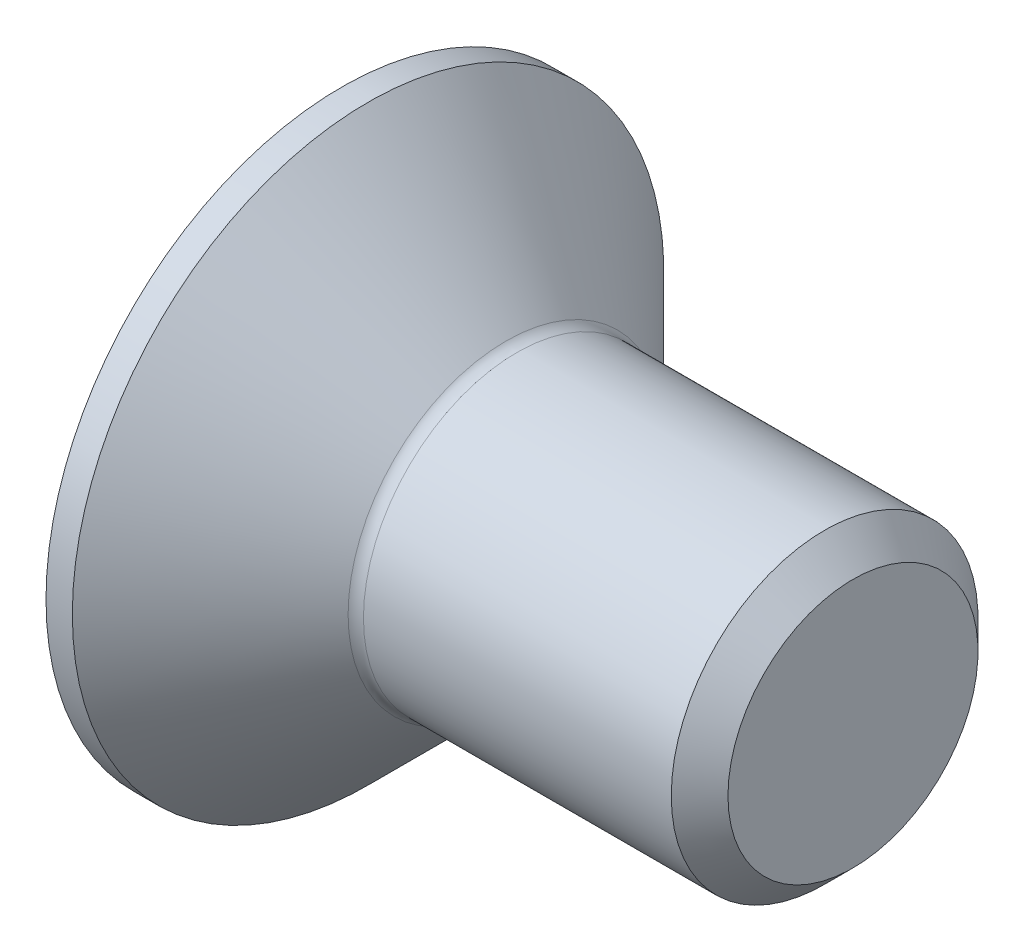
SolidWorks part; units mm, degrees
revolve "PreBroach" cut sketch "Sketch2"
sketch "Sketch2"
  line L0 (0, 2.01) -> (2.5, 2.01)
  line L1 (2.5, 2.01) -> (3.6605, 0)
  line L2 (0, 0) -> (127, 0) construction
  line L3 (3.6605, 0) -> (0, 0)
  line L4 (0, 0) -> (0, 2.01)
  line L5 (0, -2.01) -> (2.5, -2.01) construction
  line L6 (0, 0) -> (47.625, 0) construction
  line L8 (0, 5.785) -> (0, -5.785) construction
revolve "BaseBody" add sketch "BodySke" angle 360 about L6
sketch "BodySke" plane through (0, 0, 0) normal (0, 0, 1) x (1, 0, 0)
  line L0 (0, 0) -> (0, 5.785)
  line L1 (0.515, 5.785) -> (3.3, 3)
  line L2 (0, 5.785) -> (0.515, 5.785)
  line L3 (3.3, 3) -> (9.4455, 3)
  line L4 (10, 2.4455) -> (10, 0)
  line L5 (10, 0) -> (0, 0)
  line L6 (0, 0) -> (127, 0) construction
  line L7 (0.515, -5.785) -> (3.3, -3) construction
  line L8 (10, 2.4455) -> (9.4455, 3)
  line L9 (0, -5.785) -> (0.515, -5.785) construction
  line L10 (10, -2.4455) -> (9.4455, -3) construction
  line L11 (4.3, 9.35) -> (4.3, -12.875) construction
  line L12 (4.3, 16.35) -> (4.3, -5.875) construction
  dimension "Diameter" = 6
  dimension "Head_ht" = 3.3
  dimension "Length" = 10
  dimension "Body_ch_ang" = 45
  dimension "Head_dia" = 11.57
  dimension "Minor_dia" = 4.891
  dimension "Head_ang" = 90
  dimension "Advance" = 1
  dimension "Thread_nom" = 5.7
ref_plane "Plane1" through (0, 0, 0) normal (0, 0, 1) x (1, 0, 0)
ref_plane "Plane2" through (0, 0, 0) normal (0, 1, 0) x (1, 0, 0)
ref_plane "Plane3" through (0, 0, 0) normal (1, 0, 0) x (0, 0, -1)
fillet "Fillet1" radius 0.3 1 edges at (3.3, 0, 3)
sketch "Sketch3" plane through (0, 0, 0) normal (-1, 0, 0) x (0, 0, 1)
  line L0 (-2.01, -1.1605) -> (-2.01, 1.1605)
  line L1 (-2.01, 1.1605) -> (0, 2.3209)
  line L2 (0, 2.3209) -> (2.01, 1.1605)
  line L3 (2.01, 1.1605) -> (2.01, -1.1605)
  line L4 (2.01, -1.1605) -> (0, -2.3209)
  line L5 (0, -2.3209) -> (-2.01, -1.1605)
extrude "Hex" cut sketch "Sketch3" against normal blind 2.5
sketch "ThdSchSke" plane through (0, 0, 0) normal (0, 0, 1) x (1, 0, 0)
  line L0 (4.8, -2.4455) -> (4.4117, -3)
  line L1 (4.8, -2.4455) -> (5.1883, -3)
  line L2 (5.1883, -3) -> (5.1883, -3.75)
  line L3 (-3.175, 0) -> (5.1513, 0) construction
  line L4 (0, 5.785) -> (0, -5.785) construction
  line L5 (5.1883, -3.75) -> (4.4117, -3.75)
  line L6 (4.4117, -3.75) -> (4.4117, -3)
revolve "ThreadSchematic" [suppressed] cut sketch "ThdSchSke" angle 360 about L3
pattern_linear "ThdSchPat" [suppressed]
thread "Filetage1" pitch 1 start angle 0, offset 2, length 7, pitch 1, diameter 6
ref_plane "Plan1" through (11.4455, 0, 3) normal (0, -1, 0) x (0, 0, 1)
sketch "Profil de filetage1" plane through (11.4455, 0, 3) normal (0, -1, 0) x (0, 0, 1)
  line L0 (0, 0) -> (0, 1) construction
  line L11 (0, 0) -> (0, 0.875)
  line L12 (0, 0.875) -> (-0.5413, 0.5625)
  line L13 (-0.5413, 0.5625) -> (-0.5413, 0.3125)
  line L15 (-0.5413, 0.3125) -> (0, 0)
  line L17 (-0.5413, 0.4375) -> (0, 0.4375) construction
  point P2 (0, 0)
  dimension "Pitch" = 1
  dimension "Profile_Angle" = 60
  dimension "Profile_Land" = 0.25
  dimension "Profile_Height" = 0.5413
equation "\"D1@Sketch3\" = \"Hex_size@Sketch3\" / 2"
equation "\"D2@Sketch3\" = \"D1@Sketch3\""
equation "\"D3@Sketch3\" = \"Hex_size@Sketch3\""
equation "\"Thread_minor@ThdSchSke\" = \"Minor_dia@BodySke\""
equation "\"Diameter@ThdSchSke\" = \"Diameter@BodySke\""
equation "\"Overcut@ThdSchSke\" = \"Diameter@BodySke\" * 1.25"
